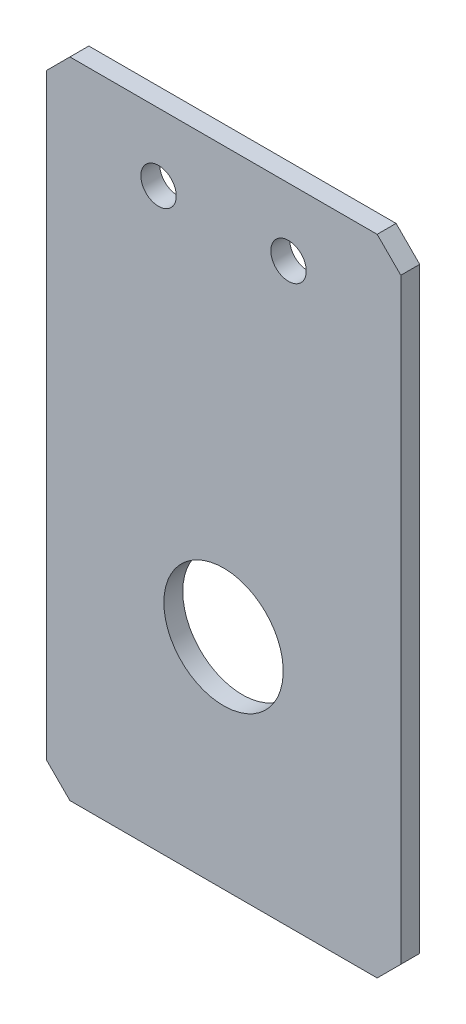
SolidWorks part; units mm, degrees
ref_plane "Face" through (0, 0, 0) normal (0, 0, 1) x (1, 0, 0)
ref_plane "Dessus" through (0, 0, 0) normal (0, 1, 0) x (1, 0, 0)
ref_plane "Droite" through (0, 0, 0) normal (1, 0, 0) x (0, 0, -1)
sketch "Esquisse1" plane through (0, 0, 0) normal (0, 0, 1) x (1, 0, 0)
  line L0 (0, 0) -> (0, -46.8792) construction
  line L1 (-13, 71.6267) -> (13, 71.6267)
  line L2 (13, 71.6267) -> (15, 69.6267)
  line L3 (-13, 71.6267) -> (-15, 69.6267)
  line L4 (15, 69.6267) -> (15, 19.1267)
  line L5 (-15, 69.6267) -> (-15, 19.1267)
  line L6 (15, 19.1267) -> (13, 17.1267)
  line L7 (-15, 19.1267) -> (-13, 17.1267)
  line L8 (13, 17.1267) -> (-13, 17.1267)
  circle A0 centre (0, 35.6267) radius 5.05
  circle A1 centre (5.5, 65.9267) radius 1.5
  circle A2 centre (-5.5, 65.9267) radius 1.5
  point P6 (0, 71.6267)
  point P13 (0, 17.1267)
  dimension "D8" = 3
  dimension "D10" = 10.1
  dimension "D1" = 54.5
  dimension "D2" = 30
  dimension "D3" = 2
  dimension "D4" = 2
  dimension "D5" = 2
  dimension "D6" = 2
  dimension "D7" = 11
  dimension "D9" = 5.7
  dimension "D11" = 18.5
extrude "Extrusion1" add sketch "Esquisse1" along normal blind 1.6
